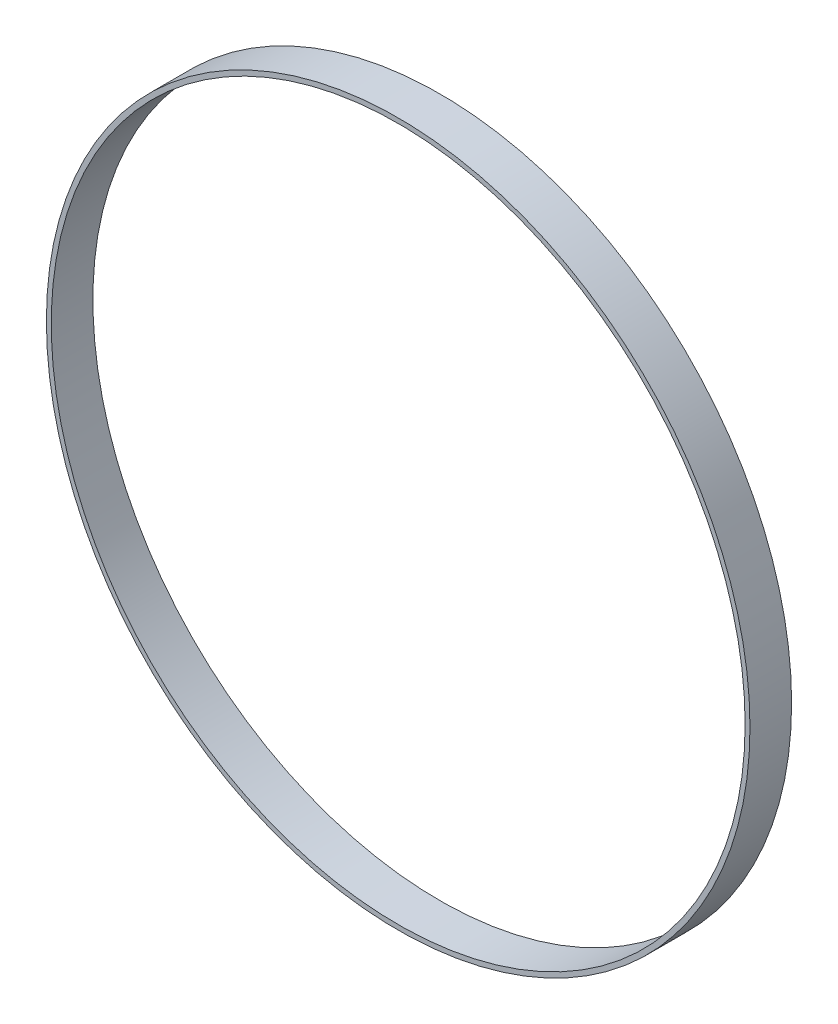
SolidWorks part; units mm, degrees
ref_plane "Plan de face" through (0, 0, 0) normal (0, 0, 1) x (1, 0, 0)
ref_plane "Plan de dessus" through (0, 0, 0) normal (0, 1, 0) x (1, 0, 0)
ref_plane "Plan de droite" through (0, 0, 0) normal (1, 0, 0) x (0, 0, -1)
sketch "Esquisse1" plane through (0, 0, 0) normal (0, 0, 1) x (1, 0, 0)
  circle A0 centre (0, 0) radius 50
  circle A1 centre (0, 0) radius 50.7
extrude "Extrusion1" add sketch "Esquisse1" along normal blind 6
